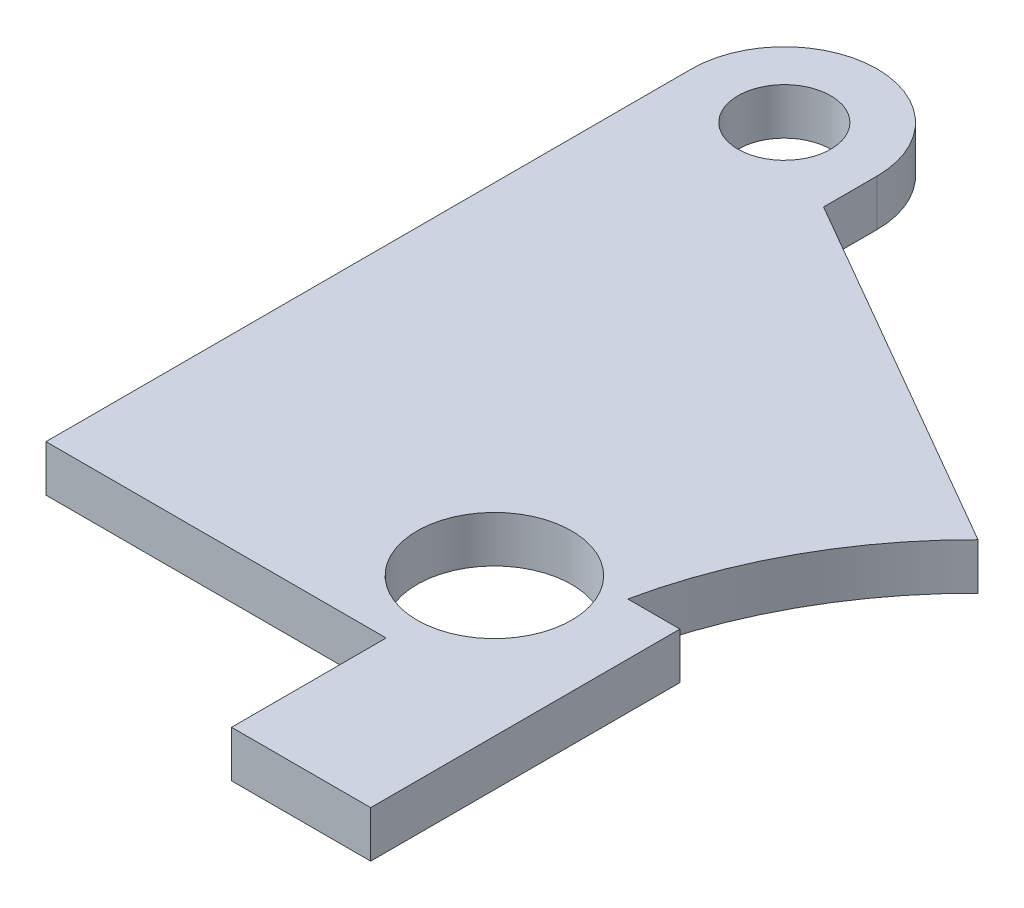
SolidWorks part; units mm, degrees
ref_plane "Front" through (0, 0, 0) normal (0, 0, 1) x (1, 0, 0)
ref_plane "Top" through (0, 0, 0) normal (0, 1, 0) x (1, 0, 0)
ref_plane "Right" through (0, 0, 0) normal (1, 0, 0) x (0, 0, -1)
sketch "Sketch1" plane through (0, 0, 0) normal (0, 1, 0) x (1, 0, 0)
  line L0 (41.5454, 34.5508) -> (66.9115, 19.9057) construction
  line L1 (27.9115, -0.0943) -> (36.9115, -0.0943)
  line L2 (5.9117, -0.0943) -> (61, -0.0943) construction
  line L3 (27.9115, -0.0943) -> (27.9115, 48.7732) construction
  line L4 (5.9117, 9.9057) -> (61, 9.9057) construction
  line L5 (17.9115, 51.66) -> (17.9115, 48.1959)
  line L6 (5.9117, 9.9057) -> (27.9115, 9.9057)
  line L7 (27.9115, -0.0943) -> (27.9115, 9.9057)
  line L8 (36.9115, -0.0943) -> (36.9115, 19.9057)
  line L9 (66.9115, 19.9057) -> (66.9115, 9.9057) construction
  line L10 (5.9117, 9.9057) -> (5.9117, 51.7024)
  line L11 (66.9115, 19.9057) -> (58.0523, 19.9057) construction
  line L16 (41.5454, 34.5508) -> (17.9115, 48.1959)
  line L19 (33.539, 19.9057) -> (36.9115, 19.9057)
  line L21 (36.9115, -0.0943) -> (36.9115, 48.7732) construction
  circle A0 centre (11.9115, 51.66) radius 3
  arc A1 (17.9115, 51.66) -> (5.9117, 51.7024) centre (11.9115, 51.66) ccw
  circle A2 centre (27.9115, 16.9057) radius 5
  arc A3 (41.5454, 34.5508) -> (33.539, 19.9057) centre (61.9115, 13.9057) ccw
  dimension "D1" = 16
  dimension "D5" = 10
  dimension "D6" = 7
  dimension "D7" = 6
  dimension "D8" = 6
  dimension "D9" = 29
  dimension "D12" = 30
  dimension "D13" = 31.7543
  dimension "D16" = 16
  dimension "D2" = 9
  dimension "D3" = 25
  dimension "D4" = 4
  dimension "D10" = 5
  dimension "D11" = 6
  dimension "D14" = 5.9117
  dimension "D15" = 9.9057
  dimension "D17" = 10
extrude "Extrude1" add sketch "Sketch1" along normal blind 3
